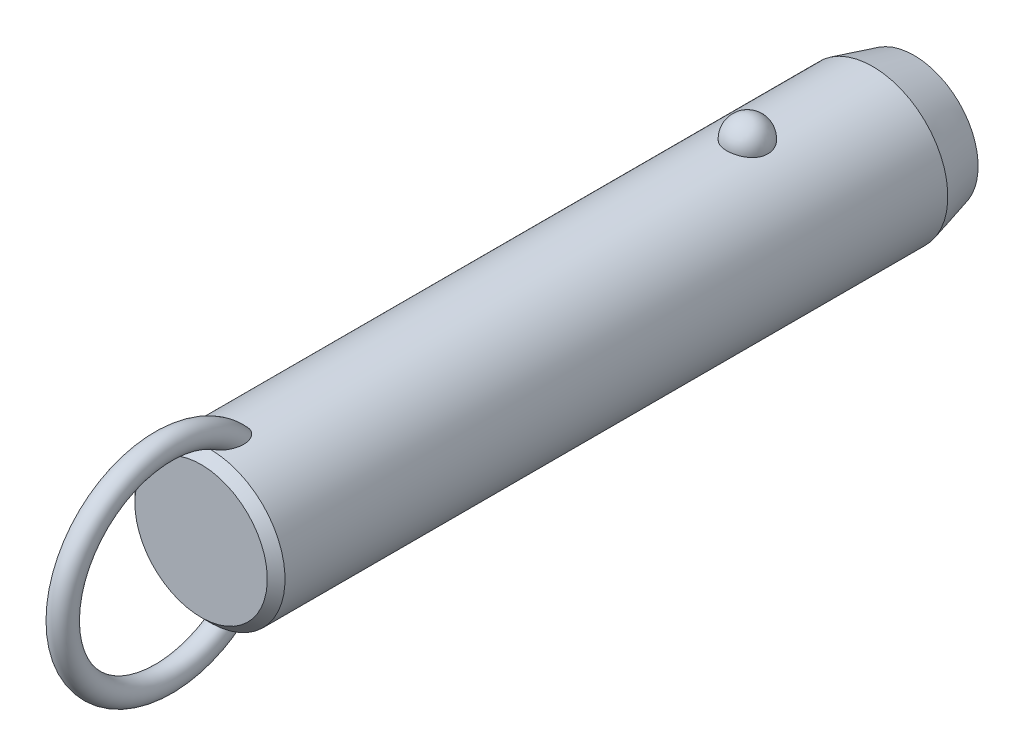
SolidWorks part; units mm, degrees
ref_plane "Front Plane" through (0, 0, 0) normal (0, 0, 1) x (1, 0, 0)
ref_plane "Top Plane" through (0, 0, 0) normal (0, 1, 0) x (1, 0, 0)
ref_plane "Right Plane" through (0, 0, 0) normal (1, 0, 0) x (0, 0, -1)
sketch "Sketch2" plane through (0, 0, 0) normal (0, 0, 1) x (1, 0, 0)
  circle A0 centre (0, 0) radius 12.7
  point P3 (0, 12.7)
  dimension "D1" = 25.4
extrude "Boss-Extrude1" add sketch "Sketch2" along normal blind 76.2
sketch "Sketch3" plane through (0, 0, 0) normal (0, 0, -1) x (-1, 0, 0)
  circle A0 centre (0, 0) radius 12.7
  dimension "D1" = 25.4
extrude "Boss-Extrude2" add sketch "Sketch3" along normal blind 31.7
chamfer "Chamfer1" distance 7 angle 15 1 edges at (-12.7, 0, -31.7)
sketch "Sketch12" plane through (0, 0, 0) normal (1, 0, 0) x (0, 0, -1)
  line L0 (-76.2, 12.7) -> (-76.2, -12.7) construction
  point P0 (-76.2, 0)
sketch "Sketch13" plane through (0, 0, 0) normal (1, 0, 0) x (0, 0, -1)
  circle A0 centre (-95.25, 0) radius 19.05
  point P2 (-76.2, 0)
  dimension "D1" = 38.1
sketch "Sketch14" plane through (0, 0, 0) normal (0, 1, 0) x (1, 0, 0)
  circle A0 centre (0, -78.2) radius 2
  point P2 (0, -76.2)
  dimension "D1" = 4
sweep "Sweep1" add profiles "Sketch14" path "Sketch13"
sketch "Sketch15" plane through (0, 0, 76.2) normal (0, 0, 1) x (1, 0, 0)
  circle A0 centre (0, 0) radius 12.7
  dimension "D1" = 25.4
extrude "Boss-Extrude3" add sketch "Sketch15" along normal blind 12.7
chamfer "Chamfer2" distance 1.5 angle 45 1 edges at (12.7, 0, 88.9)
sketch "Sketch18" plane through (0, 0, 0) normal (1, 0, 0) x (0, 0, -1)
  line L0 (24.7, 12.7) -> (-81.051, 12.7) construction
  line L1 (3.5, 16.2) -> (3.5, 9.2)
  line L2 (-81.051, -12.7) -> (24.7, -12.7) construction
  arc A0 (3.5, 16.2) -> (3.5, 9.2) centre (3.5, 12.7) ccw
  point P4 (0, 12.7)
  dimension "D1" = 28.9
revolve "Revolve1" add sketch "Sketch18" angle 360 about L1
